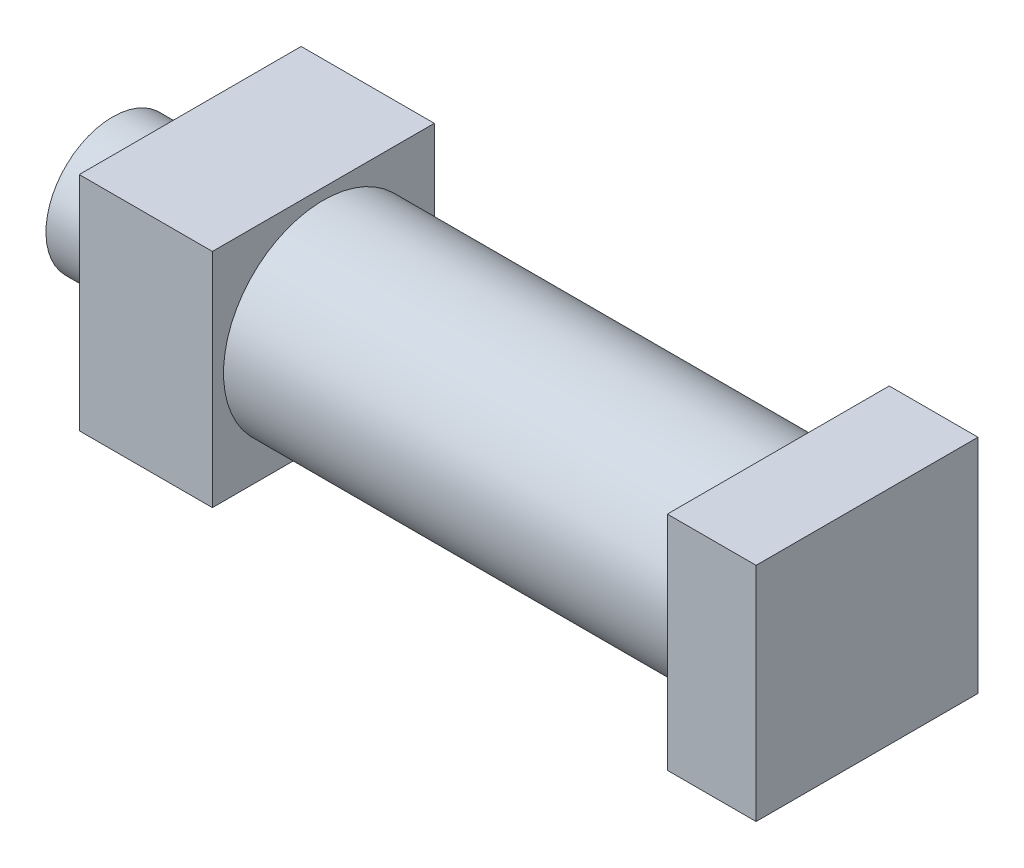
SolidWorks part; units mm, degrees
ref_plane "front" through (0, 0, 0) normal (0, 0, 1) x (1, 0, 0)
ref_plane "top" through (0, 0, 0) normal (0, 1, 0) x (1, 0, 0)
ref_plane "side" through (0, 0, 0) normal (1, 0, 0) x (0, 0, -1)
sketch "Sketch1" plane through (0, 0, 0) normal (1, 0, 0) x (0, 0, -1)
  line L0 (-31.75, 31.75) -> (31.75, 31.75)
  line L1 (-31.75, 31.75) -> (-31.75, -31.75)
  line L2 (31.75, -31.75) -> (-31.75, -31.75)
  line L3 (31.75, -31.75) -> (31.75, 31.75)
  line L4 (0, 31.75) -> (0, 0) construction
  line L5 (31.75, 0) -> (0, 0) construction
  dimension "E" = 63.5
extrude "Base-Extrude" add sketch "Sketch1" against normal blind 25.4
sketch "STROKE" plane through (0, 0, 0) normal (0, 0, 1) x (1, 0, 0)
  line L0 (0, 0) -> (-101.6, 0) construction
  line L1 (-101.6, 0) -> (-193.675, 0) construction
  dimension "STROKE" = 101.6
  dimension "LB" = 92.075
ref_plane "LB + STROKE" through (-193.675, 0, 0) normal (-1, 0, 0) x (0, 0, 1)
sketch "Sketch2" plane through (0, 0, 0) normal (-1, 0, 0) x (0, 0, 1)
  line L0 (0, 0) -> (28.575, 0) construction
  circle A0 centre (0, 0) radius 28.575
  circle A1 centre (0, 0) radius 25.4
  point P5 (25.4, 0)
  dimension "D1" = 3.175
  dimension "BORE" = 50.8
extrude "BORE" add sketch "Sketch2" along normal up to surface (193.675 mm away)
sketch "Sketch3" plane through (-193.675, 0, 0) normal (-1, 0, 0) x (0, 0, 1)
  line L2 (31.75, 31.75) -> (-31.75, 31.75)
  line L3 (31.75, 31.75) -> (-31.75, 31.75)
  line L4 (31.75, -31.75) -> (31.75, 31.75)
  line L7 (-31.75, 31.75) -> (-31.75, -31.75)
  line L8 (31.75, -31.75) -> (31.75, 31.75)
  line L9 (-31.75, 31.75) -> (-31.75, -31.75)
  line L10 (-31.75, -31.75) -> (31.75, -31.75)
  line L11 (-31.75, -31.75) -> (31.75, -31.75)
  dimension "D1" = 0
extrude "Boss-Extrude2" add sketch "Sketch3" against normal blind 38.1
sketch "Sketch4" plane through (-193.675, 0, 0) normal (1, 0, 0) x (0, 0, -1)
  circle A0 centre (0, 0) radius 19.05
  dimension "B" = 38.1
extrude "Boss-Extrude3" add sketch "Sketch4" against normal blind 22.225
sketch "Sketch5" plane through (-215.9, 0, 0) normal (-1, 0, 0) x (0, 0, 1)
  circle A0 centre (0, 0) radius 12.7
  dimension "MM_ROD_DIA" = 25.4
extrude "Cut-Extrude1" cut sketch "Sketch5" against normal up to surface (190.5 mm away)
sketch "Sketch6" plane through (148.5418, -31.75, 0.8139) normal (0, -1, 0) x (1, 0, 0)
  line L0 (-161.2418, 30.9361) -> (-161.2418, -11.9264) construction
  line L1 (-323.1668, 30.9361) -> (-323.1668, -32.5639) construction
  line L2 (-173.9418, -0.8139) -> (-138.5475, -0.8139) construction
  line L3 (-304.1168, 30.9361) -> (-342.2168, 30.9361) construction
  line L4 (-173.9418, -32.5639) -> (-173.9418, 30.9361) construction
  line L5 (-173.9418, 30.9361) -> (-148.5418, 30.9361) construction
  line L6 (-304.1168, -32.5639) -> (-342.2168, -32.5639) construction
  line L7 (-161.2418, -11.9264) -> (-323.1668, -11.9264) construction
  circle A0 centre (-161.2418, 10.2986) radius 3.9687
  circle A2 centre (-161.2418, -11.9264) radius 3.9687
  circle A3 centre (-323.1668, -11.9264) radius 3.9687
  circle A4 centre (-323.1668, 10.2986) radius 3.9687
  dimension "D1" = 22.225
  dimension "D2" = 7.9375
extrude "TAPPED BASE HOLES - MS4" cut sketch "Sketch6" against normal blind 19.05
sketch "Sketch10" plane through (0, 0, 0) normal (0, 0, 1) x (1, 0, 0)
  line L0 (-174.625, 31.75) -> (-174.625, -31.75) construction
  line L1 (-155.575, 31.75) -> (-193.675, 31.75) construction
  line L2 (-155.575, -31.75) -> (-193.675, -31.75) construction
  circle A0 centre (-174.625, 0) radius 12.7
  dimension "TD" = 25.4
extrude "HEAD TRUNION - MT1" [suppressed] add sketch "Sketch10" along normal mid plane 114.3
sketch "Sketch11" plane through (0, 0, 0) normal (0, 0, 1) x (1, 0, 0)
  line L0 (0, 0) -> (29.8231, 0) construction
  line L1 (-155.575, 0) -> (-215.9, 0) construction
  line L2 (31.75, -9.525) -> (31.75, 9.525)
  line L3 (31.75, 9.525) -> (0, 21.0811)
  line L4 (0, 31.75) -> (0, -31.75) construction
  line L5 (0, 21.0811) -> (0, -21.0811)
  line L6 (31.75, -9.525) -> (0, -21.0811)
  circle A0 centre (19.05, 0) radius 15.875 construction
  circle A1 centre (19.05, 0) radius 6.3627
  point P10 (0, 0)
  point P12 (31.75, 0)
  dimension "MR" = 15.875
  dimension "CD" = 12.7254
  dimension "D2" = 70
  dimension "L" = 19.05
  dimension "M" = 12.7
extrude "CAP EYE - MP3" [suppressed] add sketch "Sketch11" along normal mid plane 19.05
